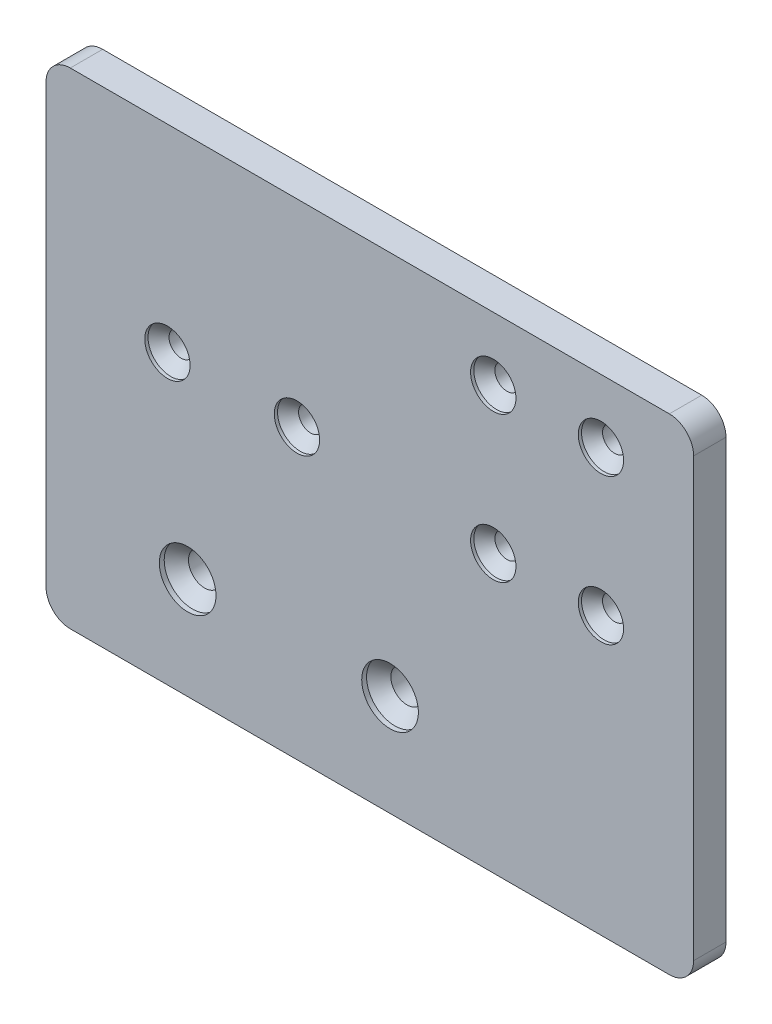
SolidWorks part; units mm, degrees
ref_plane "Přední rovina" through (0, 0, 0) normal (0, 0, 1) x (1, 0, 0)
ref_plane "Horní rovina" through (0, 0, 0) normal (0, 1, 0) x (1, 0, 0)
ref_plane "Pravá rovina" through (0, 0, 0) normal (1, 0, 0) x (0, 0, -1)
sketch "Skica1" plane through (0, 0, 0) normal (0, 0, 1) x (1, 0, 0)
  line L0 (-20, -2.4) -> (53.4, -2.4) construction
  line L1 (-23, -2.4) -> (57, -2.4)
  line L2 (-23, -2.4) -> (-23, 57.6)
  line L3 (-23, 57.6) -> (57, 57.6)
  line L4 (57, -2.4) -> (57, 57.6)
  line L5 (-20, -2.4) -> (-20, 54.3382) construction
  circle A0 centre (-8, 33.196) radius 1.5
  circle A1 centre (8, 33.196) radius 1.5
  circle A2 centre (32.25, 49.7882) radius 1.5
  circle A3 centre (45.55, 49.7882) radius 1.5
  circle A4 centre (32.25, 31.7882) radius 1.5
  circle A5 centre (45.55, 31.7882) radius 1.5
  circle A6 centre (-5.5, 10.16) radius 2
  circle A7 centre (19.5, 10.16) radius 2
  dimension "D4" = 4
  dimension "D5" = 3
  dimension "D1" = 80
  dimension "D2" = 3
  dimension "D3" = 60
extrude "Přidat vysunutím1" add sketch "Skica1" along normal blind 4
fillet "Zaoblit1" radius 3 4 edges at (-23, 57.6, 2) (-23, -2.4, 2) (57, 57.6, 2) (57, -2.4, 2)
sketch "Skica2" plane through (0, 0, 4) normal (0, 0, -1) x (-1, 0, 0)
  circle A0 centre (-45.55, 49.7882) radius 2.8
  circle A1 centre (-32.25, 49.7882) radius 2.8
  circle A2 centre (-45.55, 31.7882) radius 2.8
  circle A3 centre (-32.25, 31.7882) radius 2.8
  circle A4 centre (-8, 33.196) radius 2.8
  circle A5 centre (8, 33.196) radius 2.8
  dimension "D1" = 5.6
extrude "Odebrat vysunutím1" cut sketch "Skica2" along normal blind 0.4
chamfer "Zkosení1" distance 1.3 angle 45 6 edges at (-9.5, 33.196, 3.6) (6.5, 33.196, 3.6) (30.75, 31.7882, 3.6) (30.75, 49.7882, 3.6) (44.05, 31.7882, 3.6) (44.05, 49.7882, 3.6)
sketch "Skica3" plane through (0, 0, 4) normal (0, 0, -1) x (-1, 0, 0)
  circle A0 centre (-19.5, 10.16) radius 3.5
  circle A1 centre (5.5, 10.16) radius 3.5
  dimension "D1" = 7
extrude "Odebrat vysunutím2" cut sketch "Skica3" along normal blind 0.6
chamfer "Zkosení2" distance 1.5 angle 45 2 edges at (-7.5, 10.16, 3.4) (17.5, 10.16, 3.4)
